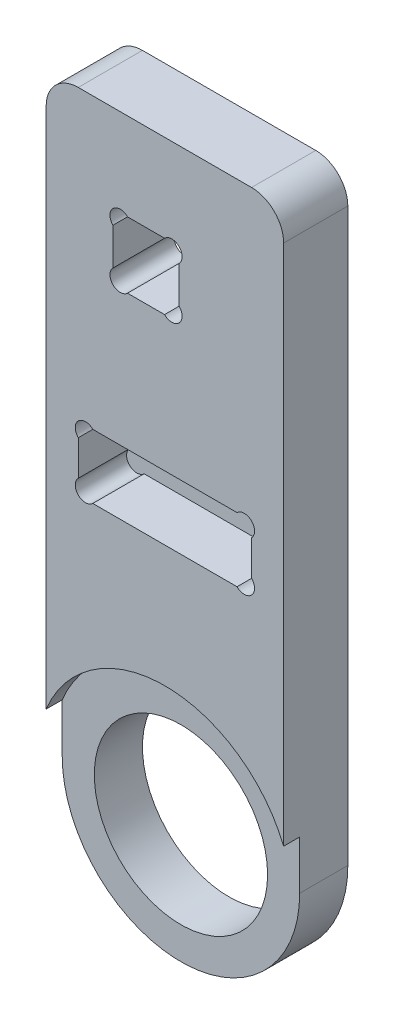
SolidWorks part; units mm, degrees
ref_plane "Plan de face" through (0, 0, 0) normal (0, 0, 1) x (1, 0, 0)
ref_plane "Plan de dessus" through (0, 0, 0) normal (0, 1, 0) x (1, 0, 0)
ref_plane "Plan de droite" through (0, 0, 0) normal (1, 0, 0) x (0, 0, -1)
sketch "Esquisse6" plane through (0, 0, 0) normal (0, 0, 1) x (1, 0, 0)
  circle A0 centre (0, 0) radius 18.5
extrude "Boss.-Extru.2" add sketch "Esquisse6" along normal blind 10
sketch "Esquisse7" plane through (0, 0, 10) normal (0, 0, 1) x (1, 0, 0)
  line L0 (-18.5, 0) -> (-18.5, 94.98)
  line L1 (-18.5, 94.98) -> (18.5, 94.98)
  line L2 (18.5, 94.98) -> (18.5, 0)
  line L3 (18.5, 0) -> (-18.5, 0)
  circle A0 centre (0, 0) radius 18.5 construction
  dimension "D1" = 94.98
extrude "Boss.-Extru.3" add sketch "Esquisse7" against normal blind 10
sketch "Esquisse8" plane through (0, 0, 10) normal (0, 0, 1) x (1, 0, 0)
  circle A0 centre (0, 0) radius 13.5
extrude "Enlèv. mat.-Extru.10" cut sketch "Esquisse8" against normal through all
sketch "Esquisse9" plane through (0, 0, 10) normal (0, 0, 1) x (1, 0, 0)
  line L1 (-13.5, 48.98) -> (-8.6188, 44.0988) construction
  line L7 (0, 38.98) -> (0, 51.2465) construction
  line L8 (13.5, 43.98) -> (-16.8509, 43.98) construction
  line L9 (-6.5753, 48.98) -> (-16.074, 48.98) construction
  line L10 (-13.5, 44.2795) -> (-13.5, 51.2465) construction
  line L12 (-11.2373, 48.98) -> (11.2373, 48.98)
  line L13 (-13.5, 46.7173) -> (-13.5, 41.2427)
  line L14 (-11.2373, 38.98) -> (11.2373, 38.98)
  line L15 (13.5, 46.7173) -> (13.5, 41.2427)
  arc A0 (-11.2373, 48.98) -> (-13.5, 46.7173) centre (-12.3686, 47.8486) ccw
  arc A1 (11.2373, 48.98) -> (13.5, 46.7173) centre (12.3686, 47.8486) cw
  arc A2 (11.2373, 38.98) -> (13.5, 41.2427) centre (12.3686, 40.1114) ccw
  arc A3 (-11.2373, 38.98) -> (-13.5, 41.2427) centre (-12.3686, 40.1114) cw
  point P3 (-12.3686, 47.8486)
  dimension "D1" = 45
  dimension "D2" = 1.6
extrude "Enlèv. mat.-Extru.11" cut sketch "Esquisse9" against normal blind 8
sketch "Esquisse11" plane through (0, 0, 10) normal (0, 0, 1) x (1, 0, 0)
  circle A0 centre (0, 0) radius 20
extrude "Enlèv. mat.-Extru.12" cut sketch "Esquisse11" against normal blind 2.5
sketch "Esquisse12" plane through (0, 0, 10) normal (0, 0, 1) x (1, 0, 0)
  line L0 (-2.9428, 80.2839) -> (-2.9428, 63.3786) construction
  line L1 (-5.8301, 80.3539) -> (-0.0556, 80.3539)
  line L2 (-8.0928, 78.0911) -> (-8.0928, 72.3166)
  line L3 (-5.8301, 70.0539) -> (-0.0556, 70.0539)
  line L4 (2.2072, 78.0911) -> (2.2072, 72.3166)
  line L5 (-8.0928, 75.2039) -> (12.8017, 75.2039) construction
  line L6 (-8.0928, 80.3539) -> (-6.2143, 78.4754) construction
  line L7 (-18.5, 94.98) -> (-18.5, 7.5993) construction
  line L10 (-8.0928, 71.2072) -> (-8.0928, 110.451) construction
  line L11 (2.2072, 82.8072) -> (2.2072, 122.051) construction
  line L12 (1.0539, 80.3539) -> (-29.009, 80.3539) construction
  arc A0 (-8.0928, 78.0911) -> (-5.8301, 80.3539) centre (-6.9614, 79.2225) cw
  arc A1 (2.2072, 78.0911) -> (-0.0556, 80.3539) centre (1.0758, 79.2225) ccw
  arc A2 (2.2072, 72.3166) -> (-0.0556, 70.0539) centre (1.0758, 71.1852) cw
  arc A3 (-8.0928, 72.3166) -> (-5.8301, 70.0539) centre (-6.9614, 71.1852) ccw
  point P11 (-6.9614, 79.2225)
  dimension "D4" = 10.3
  dimension "D1" = 10.3
  dimension "D2" = 45
  dimension "D3" = 1.6
  dimension "D5" = 10.4072
extrude "Enlèv. mat.-Extru.13" cut sketch "Esquisse12" against normal through all
sketch "Esquisse13" plane through (0, 0, 10) normal (0, 0, 1) x (1, 0, 0)
  line L0 (18.5, 7.5993) -> (18.5, 94.98) construction
  line L1 (-18.5, 94.98) -> (18.5, 94.98)
  line L2 (-18.5, 94.98) -> (-18.5, 93.98)
  line L3 (-18.5, 93.98) -> (18.5, 93.98)
  line L4 (18.5, 94.98) -> (18.5, 93.98)
  dimension "D1" = 1
extrude "Enlèv. mat.-Extru.14" cut sketch "Esquisse13" against normal through all
fillet "Congé1" radius 5 2 edges at (18.5, 93.98, 5) (-18.5, 93.98, 5)
